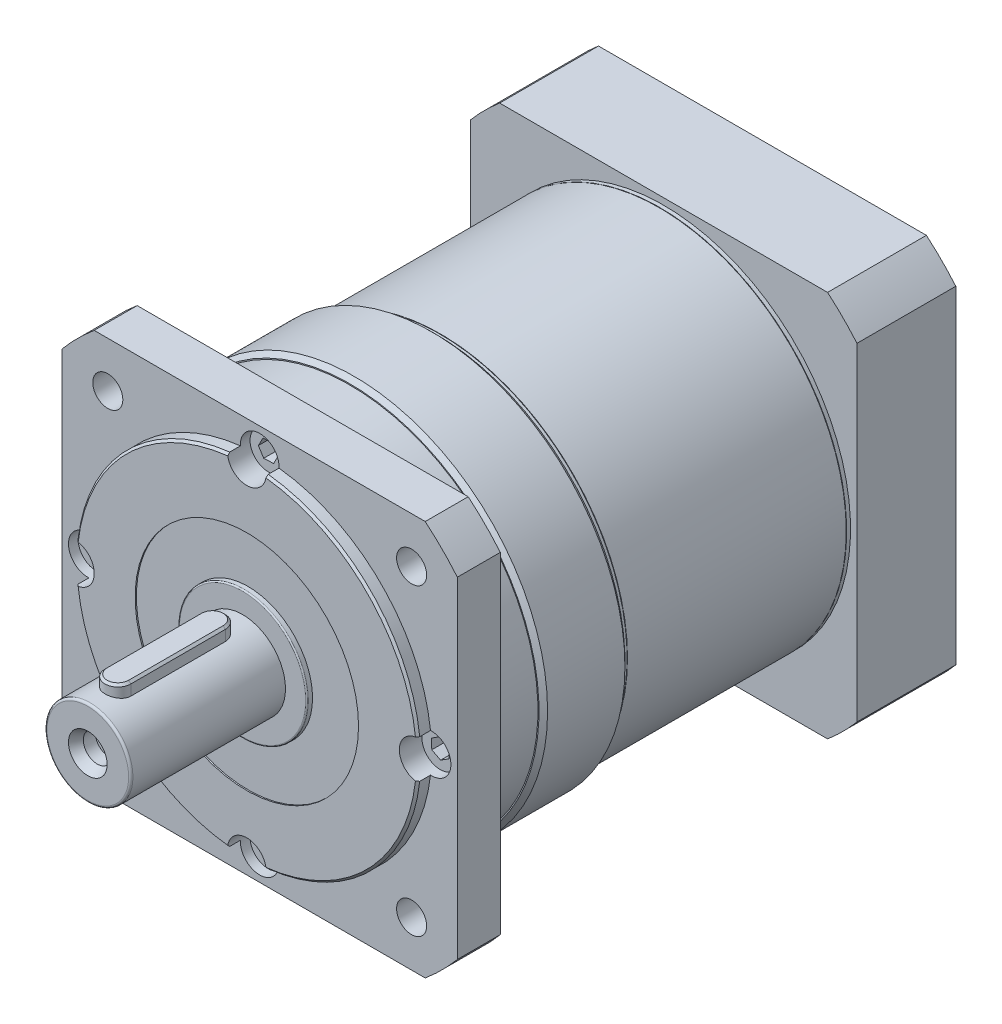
SolidWorks part; units mm, degrees
ref_plane "前视基准面" through (0, 0, 0) normal (0, 0, 1) x (1, 0, 0)
ref_plane "上视基准面" through (0, 0, 0) normal (0, 1, 0) x (1, 0, 0)
ref_plane "右视基准面" through (0, 0, 0) normal (1, 0, 0) x (0, 0, -1)
sketch "草图1" plane through (0, 0, 0) normal (0, 0, 1) x (1, 0, 0)
  circle A0 centre (0, 0) radius 45
extrude "凸台-拉伸1" add sketch "草图1" along normal blind 42
sketch "草图2" plane through (0, 0, 42) normal (0, 0, 1) x (1, 0, 0)
  circle A0 centre (0, 0) radius 40
extrude "凸台-拉伸2" add sketch "草图2" along normal blind 3
sketch "草图3" plane through (0, 0, 0) normal (0, 0, -1) x (-1, 0, 0)
  circle A0 centre (0, 0) radius 43.5
extrude "切除-拉伸1" cut sketch "草图3" against normal blind 1 flip side to cut
sketch "草图25" plane through (0, 0, 42) normal (0, 0, 1) x (1, 0, 0)
  line L1 (-46, 46) -> (46, 46)
  line L2 (-46, 46) -> (-46, -46)
  line L3 (-46, -46) -> (46, -46)
  line L4 (46, 46) -> (46, -46)
  dimension "D1" = 46
  dimension "D2" = 92
  dimension "D3" = 46
  dimension "D4" = 92
extrude "凸台-拉伸13" add sketch "草图25" against normal blind 10
sketch "草图26" plane through (0, 0, 42) normal (0, 0, 1) x (1, 0, 0)
  circle A0 centre (0, 0) radius 60
extrude "切除-拉伸8" cut sketch "草图26" against normal blind 10 flip side to cut
sketch "草图27" plane through (0, 0, 42) normal (0, 0, 1) x (1, 0, 0)
  line L0 (0, 0) -> (-42.4264, 42.4264) construction
  circle A0 centre (0, 0) radius 50 construction
  arc A1 (-38.5227, 46) -> (-46, 38.5227) centre (0, 0) ccw construction
  circle A2 centre (-35.3553, 35.3553) radius 3.5
extrude "切除-拉伸9" cut sketch "草图27" against normal blind 10
pattern_circular "阵列(圆周)6" count 4 over 360 about axis through (0, 0, 0) along (0, 0, 1) of "切除-拉伸9"
sketch "草图28" plane through (0, 0, 32) normal (0, 0, -1) x (-1, 0, 0)
  circle A0 centre (0, 0) radius 43.75
extrude "切除-拉伸10" cut sketch "草图28" along normal blind 11 flip side to cut
chamfer "倒角5" distance 1 angle 45 1 edges at (-45, 0, 21)
chamfer "倒角1" distance 1 angle 45 1 edges at (-45, 0, 1)
ref_plane "基准面1" through (0, 0, -0.1) normal (0, 0, -1) x (-1, 0, 0)
sketch "草图4" plane through (0, 0, -0.1) normal (0, 0, -1) x (-1, 0, 0)
  circle A0 centre (0, 0) radius 43.5
extrude "凸台-拉伸3" add sketch "草图4" along normal blind 50.9 separate body
ref_plane "基准面2" through (0, 0, -51.1) normal (0, 0, -1) x (-1, 0, 0)
sketch "草图5" plane through (0, 0, -51.1) normal (0, 0, -1) x (-1, 0, 0)
  circle A0 centre (0, 0) radius 43.5
extrude "凸台-拉伸4" add sketch "草图5" along normal blind 0.9 separate body
sketch "草图6" plane through (0, 0, -52) normal (0, 0, -1) x (-1, 0, 0)
  line L1 (-38.1576, 45) -> (38.1576, 45)
  line L2 (-45, 38.1576) -> (-45, -38.1576)
  line L3 (-38.1576, -45) -> (38.1576, -45)
  line L4 (45, 38.1576) -> (45, -38.1576)
  arc A0 (-38.1576, 45) -> (-45, 38.1576) centre (0, 0) ccw
  arc A1 (-45, -38.1576) -> (-38.1576, -45) centre (0, 0) ccw
  arc A2 (38.1576, -45) -> (45, -38.1576) centre (0, 0) ccw
  arc A3 (45, 38.1576) -> (38.1576, 45) centre (0, 0) ccw
  dimension "D1" = 45
  dimension "D3" = 45
extrude "凸台-拉伸5" add sketch "草图6" along normal blind 23
sketch "草图7" plane through (0, 0, -75) normal (0, 0, -1) x (-1, 0, 0)
  circle A0 centre (0, 0) radius 35
extrude "切除-拉伸2" cut sketch "草图7" against normal blind 6
sketch "草图8" plane through (0, 0, -69) normal (0, 0, -1) x (-1, 0, 0)
  circle A0 centre (0, 0) radius 32
extrude "切除-拉伸3" cut sketch "草图8" against normal blind 20
sketch "草图9" plane through (0, 0, -75) normal (0, 0, -1) x (-1, 0, 0)
  line L0 (0, 0) -> (0, 40) construction
  line L1 (0, 0) -> (-13.6808, 37.5877) construction
  circle A0 centre (0, 0) radius 40 construction
  circle A1 centre (-13.6808, 37.5877) radius 4.5
  dimension "D1" = 20
extrude "切除-拉伸4" cut sketch "草图9" against normal blind 14
pattern_circular "阵列(圆周)1" count 4 over 360 about axis through (0, 0, 0) along (0, 0, 1) of "切除-拉伸4"
sketch "草图10" plane through (0, 0, -75) normal (0, 0, -1) x (-1, 0, 0)
  line L0 (0, 0) -> (-31.8198, 31.8198)
  circle A0 centre (0, 0) radius 45
hole_wizard "M5 螺纹孔1" positions "3D草图1" profile "草图11" tap size "M5" standard "GB"
sketch3d "3D草图1"
  point P0 (31.8198, 31.8198, -75)
sketch "草图11" plane through (31.8198, 31.8198, -75) normal (1, 0, 0) x (0, 1, 0)
  line L0 (0, 0) -> (0, 17.2618)
  line L1 (0, 17.2618) -> (2.1, 16)
  line L2 (2.1, 16) -> (2.1, 0)
  line L5 (2.1, 0) -> (0, 0)
  line L10 (0, 17.2618) -> (-2.1, 16) construction
  line L11 (0, -6.35) -> (0, 107.95) construction
  dimension "螺纹孔钻头直径" = 4.2
  dimension "螺纹孔钻头深度" = 16
  dimension "导头角度" = 118
pattern_circular "阵列(圆周)2" count 4 over 360 about axis through (0, 0, 0) along (0, 0, 1) of "M5 螺纹孔1"
sketch "草图12" plane through (0, 0, -61) normal (0, 0, -1) x (-1, 0, 0)
  line L1 (-12.6133, 39.6356) -> (-14.9205, 39.5362)
  line L2 (-14.9205, 39.5362) -> (-15.9881, 37.4883)
  line L3 (-15.9881, 37.4883) -> (-14.7484, 35.5399)
  line L4 (-14.7484, 35.5399) -> (-12.4411, 35.6393)
  line L5 (-12.4411, 35.6393) -> (-11.3735, 37.6871)
  line L6 (-11.3735, 37.6871) -> (-12.6133, 39.6356)
  circle A0 centre (-13.6808, 37.5877) radius 4.25
  circle A1 centre (-13.6808, 37.5877) radius 2 construction
  dimension "D1" = 4
extrude "凸台-拉伸6" add sketch "草图12" along normal blind 5
pattern_circular "阵列(圆周)3" count 4 over 360 about axis through (0, 0, 0) along (0, 0, 1) of "凸台-拉伸6"
sketch "草图13" plane through (0, 0, 42) normal (0, 0, 1) x (1, 0, 0)
  line L0 (0, 0) -> (0, -40) construction
  circle A0 centre (0, 0) radius 40 construction
  circle A1 centre (0, -40) radius 4.5
extrude "切除-拉伸5" cut sketch "草图13" against normal blind 7
pattern_circular "阵列(圆周)4" count 4 over 360 about axis through (0, 0, 0) along (0, 0, 1) of "切除-拉伸5"
sketch "草图14" plane through (0, 0, 35) normal (0, 0, 1) x (1, 0, 0)
  line L1 (1.0702, -37.9535) -> (-1.2372, -38.05)
  line L2 (-1.2372, -38.05) -> (-2.3074, -40.0965)
  line L3 (-2.3074, -40.0965) -> (-1.0702, -42.0465)
  line L4 (-1.0702, -42.0465) -> (1.2372, -41.95)
  line L5 (1.2372, -41.95) -> (2.3074, -39.9035)
  line L6 (2.3074, -39.9035) -> (1.0702, -37.9535)
  circle A0 centre (0, -40) radius 4.25
  circle A1 centre (0, -40) radius 2 construction
  dimension "D1" = 4
extrude "凸台-拉伸7" add sketch "草图14" along normal blind 5
pattern_circular "阵列(圆周)5" count 4 over 360 about axis through (0, 0, 0) along (0, 0, 1) of "凸台-拉伸7"
sketch "草图15" plane through (0, 0, 42) normal (0, 0, 1) x (1, 0, 0)
  line L0 (0, 0) -> (-24.7487, 24.7487)
  circle A0 centre (0, 0) radius 35
ref_plane "基准面3" through (0, 0, -68) normal (0, 0, -1) x (-1, 0, 0)
sketch "草图17" plane through (0, 0, -68) normal (0, 0, -1) x (-1, 0, 0)
  circle A0 centre (0, 0) radius 26
extrude "凸台-拉伸8" add sketch "草图17" against normal up to surface (19 mm away)
chamfer "倒角2" distance 1.5 angle 45 1 edges at (-26, 0, -68)
sketch "草图18" plane through (0, 0, -68) normal (0, 0, -1) x (-1, 0, 0)
  line L1 (-30.5825, 0.5) -> (30.8028, 0.5)
  line L2 (-30.5825, 0.5) -> (-30.5825, -0.5)
  line L3 (-30.5825, -0.5) -> (30.8028, -0.5)
  line L4 (30.8028, 0.5) -> (30.8028, -0.5)
  dimension "D1" = 0.5
  dimension "D2" = 1
extrude "切除-拉伸6" cut sketch "草图18" against normal up to surface (19 mm away)
sketch "草图19" plane through (0, 0, -75) normal (0, 0, -1) x (-1, 0, 0)
  circle A0 centre (0, 0) radius 9.5
extrude "切除-拉伸7" cut sketch "草图19" against normal blind 42
chamfer "倒角3" distance 0.5 angle 45 1 edges at (40, 0, 45)
sketch "草图20" plane through (0, 0, 45) normal (0, 0, 1) x (1, 0, 0)
  circle A0 centre (0, 0) radius 15
extrude "凸台-拉伸9" add sketch "草图20" along normal blind 1
fillet "圆角2" radius 0.3 1 edges at (15, 0, 46)
sketch "草图22" plane through (0, 0, 46) normal (0, 0, 1) x (1, 0, 0)
  circle A0 centre (0, 0) radius 10
extrude "凸台-拉伸10" add sketch "草图22" along normal blind 36
fillet "圆角3" radius 0.5 1 edges at (10, 0, 82)
sketch "草图23" plane through (0, 0, 0) normal (0, 1, 0) x (1, 0, 0)
  line L0 (-9.5, -82) -> (9.5, -82) construction
  line L1 (-3, -53) -> (-3, -75)
  line L2 (3, -53) -> (3, -75)
  arc A0 (-3, -75) -> (3, -75) centre (0, -75) ccw
  arc A1 (3, -53) -> (-3, -53) centre (0, -53) ccw
  dimension "D1" = 7
  dimension "D2" = 22
extrude "凸台-拉伸11" add sketch "草图23" along normal blind 12.5
chamfer "倒角4" distance 0.5 angle 45 4 edges at (-3, 12.5, 64) (0, 12.5, 78) (0, 12.5, 50) (3, 12.5, 64)
sketch "草图30" plane through (0, 0, 45) normal (0, 0, 1) x (1, 0, 0)
  circle A0 centre (0, 40) radius 4.5
extrude "切除-拉伸11" cut sketch "草图30" against normal up to surface (3 mm away)
pattern_circular "阵列(圆周)8" count 4 over 360 about axis through (0, 0, 45) along (0, 0, -1) of "切除-拉伸11"
sketch "草图31" plane through (0, 0, 82) normal (0, 0, 1) x (1, 0, 0)
  circle A0 centre (0, 0) radius 4.5
ref_plane "基准面4" through (0, 0, 79.8) normal (0, 0, 1) x (1, 0, 0)
sketch "草图32" plane through (0, 0, 82) normal (0, 0, 1) x (1, 0, 0)
  circle A0 centre (0, 0) radius 3.25
extrude "切除-拉伸12" cut sketch "草图32" against normal blind 5
sketch "草图33" plane through (0, 0, 79.8) normal (0, 0, 1) x (1, 0, 0)
  circle A0 centre (0, 0) radius 3.25 construction
  circle A1 centre (0, 0) radius 3.25
loft "切除-放样1" cut profiles "草图33", "草图31"
hole_wizard "M6 螺纹孔1" positions "3D草图2" profile "草图34" tap size "M6" standard "GB"
sketch3d "3D草图2"
  line L0 (0, 0, 77) -> (0, 0, 79.8) construction
  point P0 (0, 0, 77)
sketch "草图34" plane through (0, 0, 77) normal (1, 0, 0) x (0, -1, 0)
  line L0 (0, 0) -> (0, 18.0022)
  line L1 (0, 18.0022) -> (2.5, 16.5)
  line L2 (2.5, 16.5) -> (2.5, 0)
  line L5 (2.5, 0) -> (0, 0)
  line L10 (0, 18.0022) -> (-2.5, 16.5) construction
  line L11 (0, -6.35) -> (0, 107.95) construction
  dimension "螺纹孔钻头直径" = 5
  dimension "螺纹孔钻头深度" = 16.5
  dimension "导头角度" = 118
sketch "草图35" plane through (0, 0, 45) normal (0, 0, 1) x (1, 0, 0)
  circle A0 centre (0, 0) radius 26
  circle A1 centre (0, 0) radius 15
extrude "切除-拉伸13" cut sketch "草图35" against normal blind 0.3
